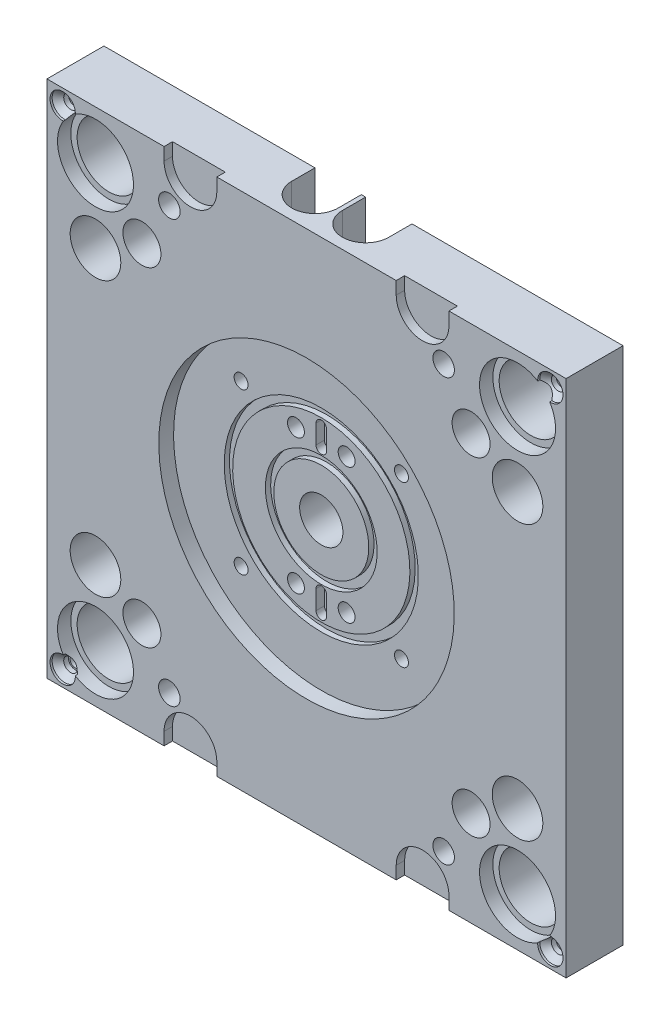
SolidWorks part; units mm, degrees
ref_plane "Plan de face" through (0, 0, 0) normal (0, 0, 1) x (1, 0, 0)
ref_plane "Plan de dessus" through (0, 0, 0) normal (0, 1, 0) x (1, 0, 0)
ref_plane "Plan de droite" through (0, 0, 0) normal (1, 0, 0) x (0, 0, -1)
sketch "Esquisse1" plane through (0, 0, 0) normal (0, 0, 1) x (1, 0, 0)
  line L1 (-123, 123) -> (123, 123)
  line L2 (-123, 123) -> (-123, -123)
  line L3 (-123, -123) -> (123, -123)
  line L4 (123, 123) -> (123, -123)
  dimension "D1" = 246
  dimension "D2" = 246
  dimension "D3" = 123
  dimension "D4" = 123
extrude "ExtrusionPlaque" add sketch "Esquisse1" along normal blind 27
sketch "Esquisse2" plane through (0, 0, 0) normal (1, 0, 0) x (0, 0, -1)
  line L0 (2.3658, 0) -> (-28.3416, 0) construction
  line L1 (0, 10.25) -> (-20, 10.25)
  line L2 (0, -123) -> (0, 123) construction
  line L3 (-20, 10.25) -> (-20, 22.5)
  line L4 (-20, 22.5) -> (-17.5, 22.5)
  line L5 (-17.5, 22.5) -> (-17.5, 26.5)
  line L6 (-17.5, 26.5) -> (-20, 26.5)
  line L7 (-20, 26.5) -> (-20, 42)
  line L8 (-20, 42) -> (-17.5, 42)
  line L9 (-17.5, 42) -> (-17.5, 46)
  line L10 (-17.5, 46) -> (-20, 46)
  line L11 (-20, 46) -> (-20, 70)
  line L12 (-20, 70) -> (-27, 70)
  line L13 (-27, -123) -> (-27, 123) construction
  line L14 (-27, 70) -> (-27, 0)
  line L15 (0, 0) -> (-27, 0)
  line L16 (0, 0) -> (0, 10.25)
  dimension "D1" = 20.5
  dimension "D2" = 7
  dimension "D3" = 2.5
  dimension "D4" = 45
  dimension "D5" = 53
  dimension "D6" = 140
  dimension "D7" = 92
  dimension "D8" = 84
revolve "LogementBlocEtJoints" cut sketch "Esquisse2" angle 360 about L0
hole_wizard "ChambrageDouille" positions "Esquisse4" profile "Esquisse3" counterbore size "24" standard "HASCO Metric"
sketch "Esquisse4" plane through (0, 0, 27) normal (0, 0, 1) x (1, 0, 0)
  point P0 (-100, 100)
sketch "Esquisse3" plane through (-100, 100, 27) normal (1, 0, 0) x (0, -1, 0)
  line L0 (0, 0) -> (0, 27)
  line L1 (0, 27) -> (15, 27)
  line L3 (15, 27) -> (15, 6.3)
  line L4 (15, 6.3) -> (18, 6.3)
  line L5 (18, 6.3) -> (18, 0)
  line L7 (18, 0) -> (0, 0)
  line L11 (0, -6.35) -> (0, 107.95) construction
  dimension "Diamètre du perçage jusqu'au prochain" = 30
  dimension "Profondeur du perçage jusqu'au prochain" = 27
  dimension "Diamètre du chambrage" = 36
  dimension "Profondeur du chambrage" = 6.3
pattern_linear "RépétitionChamDouille" count 2 spacing 200 along (1, 0, 0) count 2 spacing 200 along (0, -1, 0) of "ChambrageDouille"
hole_wizard "Chambrage pour Vis épaulée 16 mm1" positions "Esquisse6" profile "Esquisse5" counterbore size "16" standard "HASCO Metric"
sketch "Esquisse6" plane through (0, 0, 27) normal (0, 0, 1) x (1, 0, 0)
  point P0 (-100, 65)
sketch "Esquisse5" plane through (-100, 65, 27) normal (1, 0, 0) x (0, -1, 0)
  line L0 (0, 0) -> (0, 27)
  line L1 (0, 27) -> (8.5, 27)
  line L3 (8.5, 27) -> (8.5, 17)
  line L4 (8.5, 17) -> (12, 17)
  line L5 (12, 17) -> (12, 0)
  line L7 (12, 0) -> (0, 0)
  line L11 (0, -6.35) -> (0, 107.95) construction
  dimension "Diamètre du perçage jusqu'au prochain" = 17
  dimension "Profondeur du perçage jusqu'au prochain" = 27
  dimension "Diamètre du chambrage" = 24
  dimension "Profondeur du chambrage" = 17
pattern_linear "RépétitionChambrage" count 2 spacing 200 along (1, 0, 0) count 2 spacing 130 along (0, -1, 0) of "Chambrage pour Vis épaulée 16 mm1"
hole_wizard "Fraisage pour vis à tête fraisée M101" positions "Esquisse8" profile "Esquisse7" countersink size "M10" standard "HASCO Metric"
sketch "Esquisse8" plane through (0, 0, 27) normal (0, 0, 1) x (1, 0, 0)
  point P0 (-115.555, 115.555)
sketch "Esquisse7" plane through (-115.555, 115.555, 27) normal (1, 0, 0) x (0, -1, 0)
  line L0 (0, 0) -> (0, 6)
  line L1 (0, 6) -> (3.25, 6)
  line L2 (3.25, 6) -> (3.25, 3.75)
  line L3 (3.25, 3.75) -> (6, 1)
  line L4 (6, 1) -> (6, 0)
  line L6 (6, 0) -> (0, 0)
  line L7 (-3.25, 3.75) -> (-6, 1) construction
  line L10 (0, 6) -> (-3.25, 6) construction
  line L11 (0, -6.35) -> (0, 107.95) construction
  dimension "Diamètre du perçage" = 6.5
  dimension "Profondeur du perçage" = 6
  dimension "Diamètre du fraisage" = 12
  dimension "Angle du fraisage" = 90
  dimension "Angle de pointe" = 180
  dimension "Dégagement de la tête" = 1
hole_wizard "Trou taraudé M6x1.01" positions "Esquisse10" profile "Esquisse9" tap size "M6x1.0" standard "HASCO Metric"
sketch "Esquisse10" plane through (0, 0, 21) normal (0, 0, 1) x (1, 0, 0)
  point P0 (-115.555, 115.555)
sketch "Esquisse9" plane through (-115.555, 115.555, 21) normal (1, 0, 0) x (0, -1, 0)
  line L0 (0, 0) -> (0, 22.4434)
  line L1 (0, 22.4434) -> (2.5, 21)
  line L2 (2.5, 21) -> (2.5, 0)
  line L5 (2.5, 0) -> (0, 0)
  line L10 (0, 22.4434) -> (-2.5, 21) construction
  line L11 (0, -6.35) -> (0, 107.95) construction
  dimension "Diamètre du trou pour taraudage" = 5
  dimension "Profondeur du trou pour taraudage" = 21
  dimension "Angle de pointe" = 120
pattern_linear "RépétitionTrouTaraudFraisure" count 2 spacing 231.11 along (1, 0, 0) count 2 spacing 231.11 along (0, -1, 0) of "Fraisage pour vis à tête fraisée M101", "Trou taraudé M6x1.01"
hole_wizard "DégagementTirant" positions "Esquisse12" profile "Esquisse11" hole size "M16" standard "ISO"
sketch "Esquisse12" plane through (0, 0, 27) normal (0, 0, 1) x (1, 0, 0)
  point P0 (-78, 78)
sketch "Esquisse11" plane through (-78, 78, 27) normal (1, 0, 0) x (0, -1, 0)
  line L0 (0, 0) -> (0, 27)
  line L1 (0, 27) -> (9, 27)
  line L2 (9, 27) -> (9, 0)
  line L5 (9, 0) -> (0, 0)
  line L11 (0, -6.35) -> (0, 107.95) construction
  dimension "Diamètre du perçage jusqu'au prochain" = 18
  dimension "Profondeur du perçage jusqu'au prochain" = 27
pattern_linear "RépétitionDégTirant" count 2 spacing 156 along (1, 0, 0) count 2 spacing 156 along (0, -1, 0) of "DégagementTirant"
hole_wizard "TaraudageTirant" positions "Esquisse14" profile "Esquisse13" tap size "M12x1.75" standard "HASCO Metric"
sketch "Esquisse14" plane through (0, 0, 27) normal (0, 0, 1) x (1, 0, 0)
  point P0 (-65, 100)
sketch "Esquisse13" plane through (-65, 100, 27) normal (1, 0, 0) x (0, -1, 0)
  line L0 (0, 0) -> (0, 27.9445)
  line L1 (0, 27.9445) -> (5.1, 25)
  line L2 (5.1, 25) -> (5.1, 0)
  line L5 (5.1, 0) -> (0, 0)
  line L10 (0, 27.9445) -> (-5.1, 25) construction
  line L11 (0, -6.35) -> (0, 107.95) construction
  dimension "Diamètre du trou pour taraudage" = 10.2
  dimension "Profondeur du trou pour taraudage" = 25
  dimension "Angle de pointe" = 120
pattern_linear "RépétitionTaraudTirant" count 2 spacing 130 along (1, 0, 0) count 2 spacing 200 along (0, -1, 0) of "TaraudageTirant"
sketch "Esquisse15" plane through (0, 0, 27) normal (0, 0, 1) x (1, 0, 0)
  line L0 (-42.5, 117) -> (-42.5, 123)
  line L1 (123, 123) -> (-123, 123) construction
  line L2 (-42.5, 123) -> (-67.5, 123)
  line L3 (-67.5, 123) -> (-67.5, 117)
  arc A0 (-67.5, 117) -> (-42.5, 117) centre (-55, 117) ccw
extrude "EncocheDécollementPlaques" cut sketch "Esquisse15" against normal blind 4
pattern_linear "RépétitionEncoche" count 2 spacing 110 along (1, 0, 0) of "EncocheDécollementPlaques"
mirror "SymétrieEncoches" about plane through (0, 0, 0) normal (0, 1, 0) of "RépétitionEncoche", "EncocheDécollementPlaques"
hole_wizard "Perçage8Régul" positions "Esquisse17" profile "Esquisse16" hole size "8" standard "HASCO Metric"
sketch "Esquisse17" plane through (0, 0, 20) normal (0, 0, 1) x (1, 0, 0)
  point P0 (-12, 32)
sketch "Esquisse16" plane through (-12, 32, 20) normal (1, 0, 0) x (0, -1, 0)
  line L0 (0, 0) -> (0, 13)
  line L1 (0, 13) -> (4, 13)
  line L2 (4, 13) -> (4, 0)
  line L5 (4, 0) -> (0, 0)
  line L10 (0, 13) -> (-4, 13) construction
  line L11 (0, -6.35) -> (0, 107.95) construction
  dimension "Diamètre du perçage" = 8
  dimension "Profondeur du perçage" = 13
  dimension "Angle de pointe" = 180
pattern_linear "RépétitionPerçRégul" count 2 spacing 24 along (1, 0, 0) of "Perçage8Régul"
sketch "Esquisse18" plane through (0, 0, 20) normal (0, 0, 1) x (1, 0, 0)
  line L2 (2.5, 38.5) -> (2.5, 29.5)
  line L4 (-2.5, 38.5) -> (-2.5, 29.5)
  arc A0 (2.5, 38.5) -> (-2.5, 38.5) centre (0, 38.5) ccw
  arc A1 (-2.5, 29.5) -> (2.5, 29.5) centre (0, 29.5) ccw
  dimension "D3" = 29.5
  dimension "D1" = 9
  dimension "D2" = 5
  dimension "D4" = 2.5
extrude "LogementBochonSéparation" cut sketch "Esquisse18" against normal blind 4
hole_wizard "ChambrageVisFixationBloc" positions "Esquisse20" profile "Esquisse19" counterbore size "M6" standard "HASCO Metric"
sketch "Esquisse20" plane through (0, 0, 0) normal (0, 0, -1) x (-1, 0, 0)
  point P0 (38, 38)
sketch "Esquisse19" plane through (-38, 38, 0) normal (1, 0, 0) x (0, 1, 0)
  line L0 (0, 0) -> (0, 27)
  line L1 (0, 27) -> (3.3, 27)
  line L3 (3.3, 27) -> (3.3, 6)
  line L4 (3.3, 6) -> (5.5, 6)
  line L5 (5.5, 6) -> (5.5, 0)
  line L7 (5.5, 0) -> (0, 0)
  line L11 (0, -6.35) -> (0, 107.95) construction
  dimension "Diamètre du perçage jusqu'au prochain" = 6.6
  dimension "Profondeur du perçage jusqu'au prochain" = 27
  dimension "Diamètre du chambrage" = 11
  dimension "Profondeur du chambrage" = 6
pattern_linear "RépétitionChamVisBloc" count 2 spacing 76 along (1, 0, 0) count 2 spacing 76 along (0, -1, 0) of "ChambrageVisFixationBloc"
sketch "Esquisse21" plane through (0, 123, 0) normal (0, 1, 0) x (-1, 0, 0)
  line L0 (-123, 0) -> (123, 0) construction
  line L1 (1, 11) -> (1, 0)
  line L2 (1, 0) -> (23, 0)
  line L3 (23, 0) -> (23, 11)
  arc A0 (23, 11) -> (1, 11) centre (12, 11) ccw
  dimension "D3" = 22
  dimension "D1" = 11
  dimension "D2" = 12
extrude "LamageRaccords" cut sketch "Esquisse21" against normal blind 23
hole_wizard "TaraudageRaccordsCircuitRégul" positions "2" profile "3" counterbore size "8" standard "HASCO Metric"
sketch "2" plane through (0, 100, 0) normal (0, 1, 0) x (-1, 0, 0)
  point P0 (12, 11)
sketch "3" plane through (-12, 100, 11) normal (1, 0, 0) x (0, 0, 1)
  line L0 (0, 0) -> (0, 128)
  line L1 (0, 128) -> (4, 128)
  line L3 (4, 128) -> (4, 13)
  line L4 (4, 13) -> (5.75, 13)
  line L5 (5.75, 13) -> (5.75, 0)
  line L7 (5.75, 0) -> (0, 0)
  line L11 (0, -6.35) -> (0, 107.95) construction
  dimension "Diamètre du perçage jusqu'au prochain" = 8
  dimension "Profondeur du perçage jusqu'au prochain" = 128
  dimension "Diamètre du chambrage" = 11.5
  dimension "Profondeur du chambrage" = 13
mirror "SymétrieTarRaccordCircuitRégul" about plane through (0, 0, 0) normal (1, 0, 0) of "TaraudageRaccordsCircuitRégul", "LamageRaccords"
hole_wizard "SOL1_PerçageRégul" positions "Esquisse25" profile "Esquisse24" hole size "M8" standard "ISO"
sketch "Esquisse25" plane through (123, 0, 0) normal (1, 0, 0) x (0, 0, -1)
  line L0 (0, -123) -> (0, 123) construction
  point P0 (-11, -28)
  point P9 (0, 0)
  dimension "D1" = 28
sketch "Esquisse24" plane through (123, -28, 11) normal (0, 1, 0) x (0, 0, -1)
  line L0 (0, 0) -> (0, 192.4034)
  line L1 (0, 192.4034) -> (4, 190)
  line L2 (4, 190) -> (4, 0)
  line L5 (4, 0) -> (0, 0)
  line L10 (0, 192.4034) -> (-4, 190) construction
  line L11 (0, -6.35) -> (0, 107.95) construction
  dimension "Diamètre du perçage" = 8
  dimension "Profondeur du perçage" = 190
  dimension "Angle de pointe" = 118
sketch "1" plane through (-38.0763, 123, -1.191) normal (0, 1, 0) x (-1, 0, 0)
  line L1 (-1.0763, 12.191) -> (-1.0763, 0.691)
  line L2 (-1.0763, 0.691) -> (20.9237, 0.691)
  line L3 (20.9237, 0.691) -> (20.9237, 12.191)
  line L4 (-15.0763, 1.191) -> (84.9237, 1.191) construction
  arc A0 (20.9237, 12.191) -> (-1.0763, 12.191) centre (9.9237, 12.191) ccw
  dimension "D3" = 22
  dimension "D1" = 48
  dimension "D2" = 11
extrude "SOL1_LamageRaccord" [suppressed] cut sketch "1" against normal blind 23
hole_wizard "SOL1_TaraudageRaccordCircuitRégul" positions "2" profile "3" counterbore size "8" standard "HASCO Metric"
sketch "2" plane through (-38.0763, 100, -1.191) normal (0, 1, 0) x (-1, 0, 0)
  arc A0 (20.9237, 12.191) -> (-1.0763, 12.191) centre (9.9237, 12.191) ccw construction
  point P0 (9.9237, 12.191)
sketch "3" plane through (-48, 100, 11) normal (1, 0, 0) x (0, 0, 1)
  line L0 (0, 0) -> (0, 223)
  line L1 (0, 223) -> (4, 223)
  line L3 (4, 223) -> (4, 13)
  line L4 (4, 13) -> (5.75, 13)
  line L5 (5.75, 13) -> (5.75, 0)
  line L7 (5.75, 0) -> (0, 0)
  line L11 (0, -6.35) -> (0, 107.95) construction
  dimension "Diamètre du perçage jusqu'au prochain" = 8
  dimension "Profondeur du perçage jusqu'au prochain" = 223
  dimension "Diamètre du chambrage" = 11.5
  dimension "Profondeur du chambrage" = 13
mirror "SOL1_SymLamTarRaccCircRégul" [suppressed] about plane through (0, 0, 0) normal (1, 0, 0)
mirror "SOL1_SymPerç8RégulEtLogemBouchon" [suppressed] about plane through (0, 0, 0) normal (0, 1, 0)
mirror "SOL2_SymRégulExistante" about plane through (0, 0, 0) normal (0, 1, 0) of "SymétrieTarRaccordCircuitRégul", "TaraudageRaccordsCircuitRégul", "LamageRaccords", "LogementBochonSéparation", "RépétitionPerçRégul", "Perçage8Régul"
